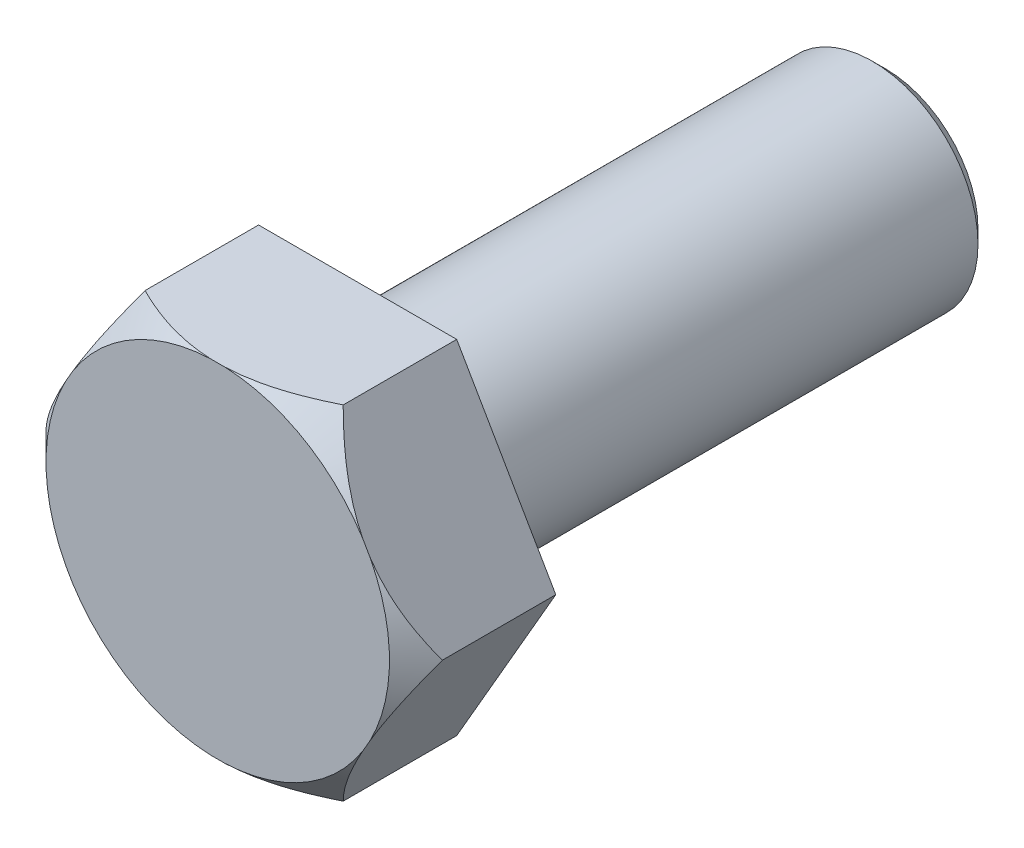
SolidWorks part; units mm, degrees
ref_plane "Plan de face" through (0, 0, 0) normal (0, 0, 1) x (1, 0, 0)
ref_plane "Plan de dessus" through (0, 0, 0) normal (0, 1, 0) x (1, 0, 0)
ref_plane "Plan de droite" through (0, 0, 0) normal (1, 0, 0) x (0, 0, -1)
sketch "Esquisse1" plane through (0, 0, 0) normal (0, 0, 1) x (1, 0, 0)
  line L1 (7.5056, 0) -> (3.7528, 6.5)
  line L2 (3.7528, 6.5) -> (-3.7528, 6.5)
  line L3 (-3.7528, 6.5) -> (-7.5056, 0)
  line L4 (-7.5056, 0) -> (-3.7528, -6.5)
  line L5 (-3.7528, -6.5) -> (3.7528, -6.5)
  line L6 (3.7528, -6.5) -> (7.5056, 0)
  circle A0 centre (0, 0) radius 6.5 construction
  dimension "D1" = 13
extrude "Boss.-Extru.1" add sketch "Esquisse1" along normal blind 5.3
sketch "Esquisse3" plane through (0, 0, 0) normal (0, 1, 0) x (1, 0, 0)
  line L0 (0, 2.9031) -> (0, -10.4428) construction
  line L1 (-7.5056, -4.3) -> (-6.5056, -5.3)
  line L2 (-9.0249, -6.1429) -> (-6.5056, -6.1429)
  line L3 (-9.0249, -6.1429) -> (-9.0249, -4.3)
  line L4 (-9.0249, -4.3) -> (-7.5056, -4.3)
  line L5 (-6.5056, -6.1429) -> (-6.5056, -5.3)
  line L6 (-7.5056, -5.3) -> (-7.5056, 0) construction
  line L8 (-3.7528, -5.3) -> (-7.5056, -5.3) construction
  dimension "D1" = 1
  dimension "D2" = 1
revolve "Enlèvement de matière-Révolution2" cut sketch "Esquisse3" angle 360 about L0
sketch "Esquisse4" plane through (0, 0, 0) normal (1, 0, 0) x (0, 0, -1)
  line L0 (0, 0) -> (83.8832, 0) construction
  line L1 (0, -4) -> (19.5, -4)
  line L2 (0, -6.5) -> (0, 0) construction
  line L3 (20, -3.5) -> (20, 0)
  line L4 (19.5, -4) -> (20, -3.5)
  line L5 (0, -4) -> (0, 0)
  line L6 (0, 0) -> (20, 0)
  point P4 (20, -4)
  dimension "D1" = 4
  dimension "D2" = 20
  dimension "D6" = 0.5
revolve "Révolution2" add sketch "Esquisse4" angle 360 about L0
